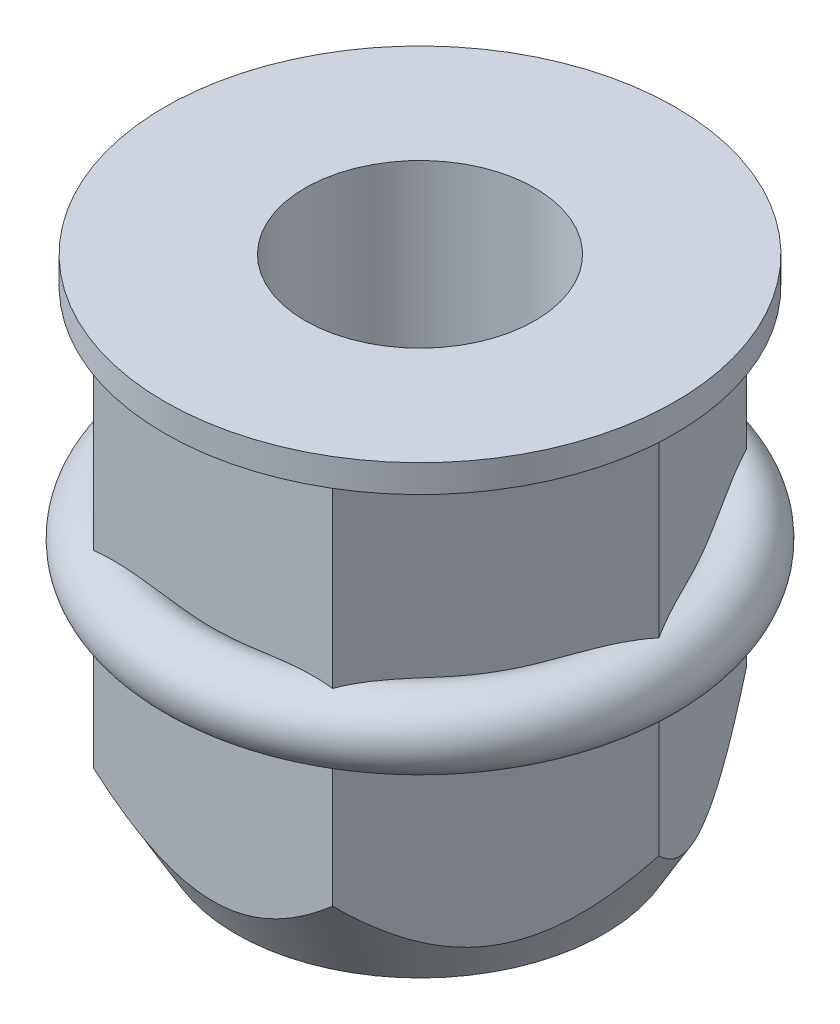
SolidWorks part; units mm, degrees
ref_plane "Face" through (0, 0, 0) normal (0, 0, 1) x (1, 0, 0)
ref_plane "Dessus" through (0, 0, 0) normal (0, 1, 0) x (1, 0, 0)
ref_plane "Droite" through (0, 0, 0) normal (1, 0, 0) x (0, 0, -1)
sketch "Esquisse1" plane through (0, 0, 0) normal (0, 1, 0) x (1, 0, 0)
  line L1 (-5.1962, 0) -> (-2.5981, -4.5)
  line L2 (-2.5981, -4.5) -> (2.5981, -4.5)
  line L3 (2.5981, -4.5) -> (5.1962, 0)
  line L4 (5.1962, 0) -> (2.5981, 4.5)
  line L5 (2.5981, 4.5) -> (-2.5981, 4.5)
  line L6 (-2.5981, 4.5) -> (-5.1962, 0)
  circle A0 centre (0, 0) radius 4.5 construction
  dimension "D1" = 9
extrude "Extrusion1" add sketch "Esquisse1" along normal blind 10.2
sketch "Esquisse2" plane through (0, 10.2, 0) normal (0, 1, 0) x (-1, 0, 0)
  circle A0 centre (0, 0) radius 5.55
  dimension "D1" = 11.1
extrude "Extrusion2" add sketch "Esquisse2" along normal blind 0.6
hole_wizard "Trou taraudé M61" positions "Esquisse3D1" profile "Esquisse3" tap size "M6" standard "ISO"
sketch3d "Esquisse3D1"
  point P0 (0, 10.8, 0)
sketch "Esquisse3" plane through (0, 10.8, 0) normal (1, 0, 0) x (0, 0, 1)
  line L0 (0, 0) -> (0, 10.8)
  line L1 (0, 10.8) -> (2.5, 10.8)
  line L2 (2.5, 10.8) -> (2.5, 0)
  line L5 (2.5, 0) -> (0, 0)
  line L11 (0, -6.35) -> (0, 107.95) construction
  dimension "Diamètre du trou pour taraudage jusqu'au prochain" = 5
  dimension "Profondeur du trou pour taraudage jusqu'au prochain" = 10.8
sketch "Esquisse4" plane through (0, 0, 0) normal (0, 0, 1) x (1, 0, 0)
  line L0 (-4, 0) -> (-7, 0)
  line L1 (-5.1962, 0) -> (-2.5981, 0) construction
  line L2 (-7, 0) -> (-7, 5.1962)
  line L3 (-7, 5.1962) -> (-4, 0)
  line L4 (0, 0) -> (0, 7.2179) construction
  line L5 (-2.5981, 0) -> (2.5981, 0) construction
  dimension "D1" = 60
  dimension "D2" = 4
  dimension "D3" = 3
revolve "Enlèvement de matière-Révolution1" cut sketch "Esquisse4" angle 360 about L4
sketch "Esquisse5" plane through (0, 0, 0) normal (0, 0, 1) x (1, 0, 0)
  line L0 (0, 0) -> (0, 14.8964) construction
  line L1 (-4, 0) -> (4, 0) construction
  line L2 (-5, 6.2) -> (-4.5349, 6.2) construction
  line L3 (-5.55, 10.2) -> (5.55, 10.2) construction
  circle A0 centre (-5, 5.45) radius 0.75
  dimension "D1" = 1.5
  dimension "D3" = 5
  dimension "D2" = 4
revolve "Révolution1" add sketch "Esquisse5" angle 360 about L0
